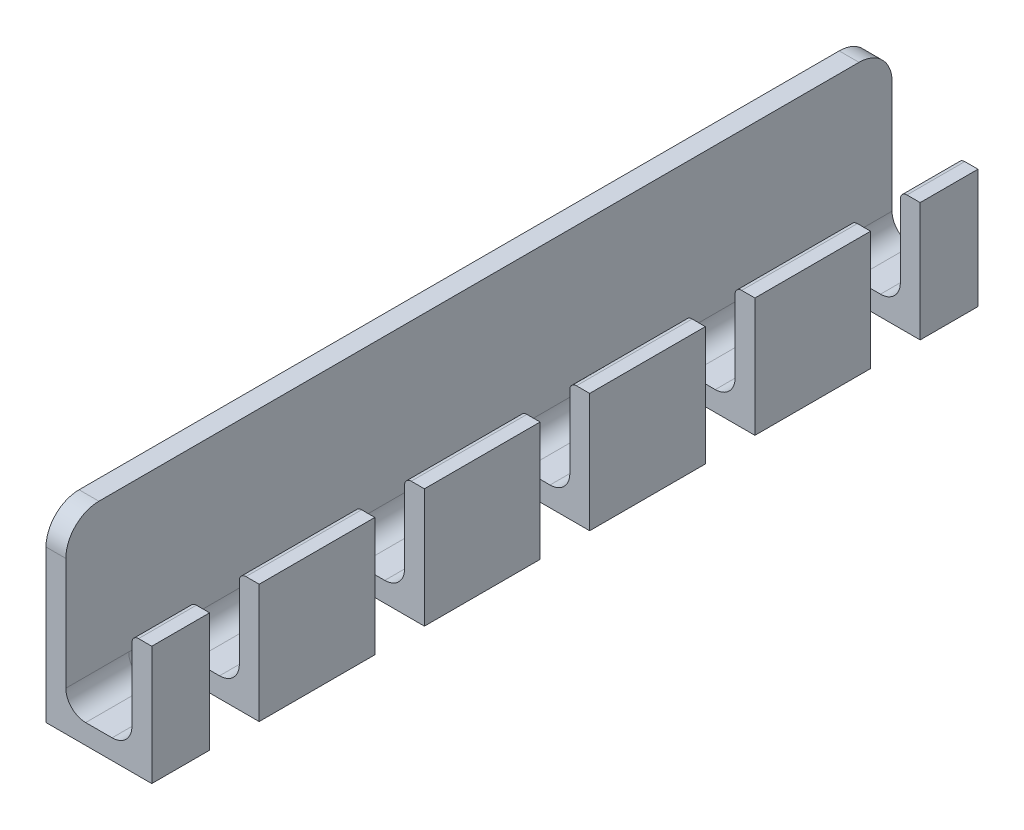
SolidWorks part; units mm, degrees
ref_plane "Plan de face" through (0, 0, 0) normal (0, 0, 1) x (1, 0, 0)
ref_plane "Plan de dessus" through (0, 0, 0) normal (0, 1, 0) x (1, 0, 0)
ref_plane "Plan de droite" through (0, 0, 0) normal (1, 0, 0) x (0, 0, -1)
sketch "Esquisse1" plane through (0, 0, 0) normal (1, 0, 0) x (0, 0, -1)
  line L0 (0, 0) -> (0, 8.2033) construction
  line L1 (-87.5, -8) -> (87.5, -8)
  line L2 (-87.5, -8) -> (-87.5, 20)
  line L3 (-87.5, 20) -> (87.5, 20)
  line L4 (87.5, -8) -> (87.5, 20)
  dimension "D1" = 28
  dimension "D2" = 175
extrude "Boss.-Extru.1" add sketch "Esquisse1" along normal blind 3
sketch "Esquisse2" plane through (3, 0, 0) normal (1, 0, 0) x (0, 0, -1)
  line L0 (87.5, -8) -> (87.5, 20) construction
  line L1 (-87.5, -8) -> (87.5, -8)
  line L2 (-87.5, -8) -> (-87.5, -5)
  line L3 (-87.5, -5) -> (87.5, -5)
  line L4 (87.5, -8) -> (87.5, -5)
  dimension "D1" = 3
extrude "Boss.-Extru.2" add sketch "Esquisse2" along normal blind 13
sketch "Esquisse5" plane through (16, 0, 0) normal (1, 0, 0) x (0, 0, -1)
  line L0 (-75, -5) -> (-75, -8) construction
  line L1 (87.5, -5) -> (-87.5, -5) construction
  line L2 (-87.5, -8) -> (87.5, -8) construction
  line L3 (-87.5, -5) -> (-87.5, -8) construction
  line L4 (-53.75, -5) -> (-46.25, -5)
  line L5 (-78.75, -5) -> (-71.25, -5)
  line L6 (-78.75, -5) -> (-78.75, -8)
  line L7 (-78.75, -8) -> (-71.25, -8)
  line L8 (-71.25, -5) -> (-71.25, -8)
  line L9 (-53.75, -5) -> (-53.75, -8)
  line L10 (-53.75, -8) -> (-46.25, -8)
  line L11 (-46.25, -5) -> (-46.25, -8)
  line L12 (-28.75, -5) -> (-21.25, -5)
  line L13 (-28.75, -5) -> (-28.75, -8)
  line L14 (-28.75, -8) -> (-21.25, -8)
  line L15 (-21.25, -5) -> (-21.25, -8)
  line L16 (-3.75, -5) -> (3.75, -5)
  line L17 (-3.75, -5) -> (-3.75, -8)
  line L18 (-3.75, -8) -> (3.75, -8)
  line L19 (3.75, -5) -> (3.75, -8)
  line L20 (21.25, -5) -> (28.75, -5)
  line L21 (21.25, -5) -> (21.25, -8)
  line L22 (21.25, -8) -> (28.75, -8)
  line L23 (28.75, -5) -> (28.75, -8)
  line L24 (46.25, -5) -> (53.75, -5)
  line L25 (46.25, -5) -> (46.25, -8)
  line L26 (46.25, -8) -> (53.75, -8)
  line L27 (53.75, -5) -> (53.75, -8)
  line L28 (71.25, -5) -> (78.75, -5)
  line L29 (71.25, -5) -> (71.25, -8)
  line L30 (71.25, -8) -> (78.75, -8)
  line L31 (78.75, -5) -> (78.75, -8)
  point P8 (-87.5, -6.5)
  dimension "D1" = 12.5
  dimension "D2" = 7.5
  dimension "D3" = 7
extrude "Enlèv. mat.-Extru.2" cut sketch "Esquisse5" against normal blind 11
sketch "Esquisse6" plane through (0, -5, 0) normal (0, 1, 0) x (1, 0, 0)
  line L0 (5, -78.75) -> (16, -78.75) construction
  line L1 (16, -87.5) -> (13, -87.5)
  line L2 (16, -87.5) -> (16, -78.75)
  line L3 (16, -78.75) -> (13, -78.75)
  line L4 (13, -87.5) -> (13, -78.75)
  dimension "D1" = 3
extrude "Boss.-Extru.5" add sketch "Esquisse6" along normal blind 15
sketch "Esquisse7" plane through (0, -5, 0) normal (0, 1, 0) x (1, 0, 0)
  line L0 (5, -53.75) -> (16, -53.75) construction
  line L1 (16, -71.25) -> (13, -71.25)
  line L2 (16, -71.25) -> (16, -53.75)
  line L3 (16, -53.75) -> (13, -53.75)
  line L4 (13, -71.25) -> (13, -53.75)
  dimension "D1" = 3
extrude "Boss.-Extru.6" add sketch "Esquisse7" along normal blind 15
sketch "Esquisse8" plane through (0, -5, 0) normal (0, 1, 0) x (1, 0, 0)
  line L0 (5, -28.75) -> (16, -28.75) construction
  line L1 (16, -46.25) -> (13, -46.25)
  line L2 (16, -46.25) -> (16, -28.75)
  line L3 (16, -28.75) -> (13, -28.75)
  line L4 (13, -46.25) -> (13, -28.75)
  line L5 (5, -3.75) -> (16, -3.75) construction
  line L6 (16, -21.25) -> (13, -21.25)
  line L7 (16, -21.25) -> (16, -3.75)
  line L8 (16, -3.75) -> (13, -3.75)
  line L9 (13, -21.25) -> (13, -3.75)
  line L10 (5, 21.25) -> (16, 21.25) construction
  line L11 (16, 3.75) -> (13, 3.75)
  line L12 (16, 3.75) -> (16, 21.25)
  line L13 (16, 21.25) -> (13, 21.25)
  line L14 (13, 3.75) -> (13, 21.25)
  line L15 (5, 46.25) -> (16, 46.25) construction
  line L16 (16, 28.75) -> (13, 28.75)
  line L17 (16, 28.75) -> (16, 46.25)
  line L18 (16, 46.25) -> (13, 46.25)
  line L19 (13, 28.75) -> (13, 46.25)
  line L20 (5, 71.25) -> (16, 71.25) construction
  line L21 (16, 53.75) -> (13, 53.75)
  line L22 (16, 53.75) -> (16, 71.25)
  line L23 (16, 71.25) -> (13, 71.25)
  line L24 (13, 53.75) -> (13, 71.25)
  line L25 (16, 87.5) -> (3, 87.5) construction
  line L26 (16, 78.75) -> (13, 78.75)
  line L27 (16, 78.75) -> (16, 87.5)
  line L28 (16, 87.5) -> (13, 87.5)
  line L29 (13, 78.75) -> (13, 87.5)
  dimension "D1" = 3
extrude "Boss.-Extru.7" add sketch "Esquisse8" along normal blind 15
fillet "Congé1" radius 3 14 edges at (5, -6.5, -78.75) (5, -6.5, -53.75) (5, -6.5, -28.75) (5, -6.5, -3.75) (5, -6.5, -71.25) (5, -6.5, -46.25) (5, -6.5, -21.25) (5, -6.5, 3.75) (5, -6.5, 28.75) (5, -6.5, 53.75) (5, -6.5, 21.25) (5, -6.5, 46.25) (5, -6.5, 71.25) (5, -6.5, 78.75)
fillet "Congé2" radius 3 8 edges at (13, -5, 83.125) (13, -5, 62.5) (13, -5, 37.5) (13, -5, 12.5) (13, -5, -12.5) (13, -5, -62.5) (13, -5, -37.5) (13, -5, -83.125)
fillet "Congé3" radius 3 1 edges at (3, -5, 0)
fillet "Congé5" radius 1 8 edges at (13, 10, 83.125) (13, 10, 62.5) (13, 10, 37.5) (13, 10, 12.5) (13, 10, -12.5) (13, 10, -37.5) (13, 10, -62.5) (13, 10, -83.125)
sketch "Esquisse10" plane through (16, 0, 0) normal (1, 0, 0) x (0, 0, -1)
  line L0 (28.75, -8) -> (46.25, -8) construction
  line L1 (37.5, -8) -> (90.1144, -8)
  line L2 (37.5, -8) -> (37.5, 24.1306)
  line L3 (37.5, 24.1306) -> (90.1144, 24.1306)
  line L4 (90.1144, -8) -> (90.1144, 24.1306)
extrude "Enlèv. mat.-Extru.3" cut sketch "Esquisse10" against normal through all
fillet "Congé6" radius 5 2 edges at (1.5, 20, 87.5) (1.5, 20, -37.5)
